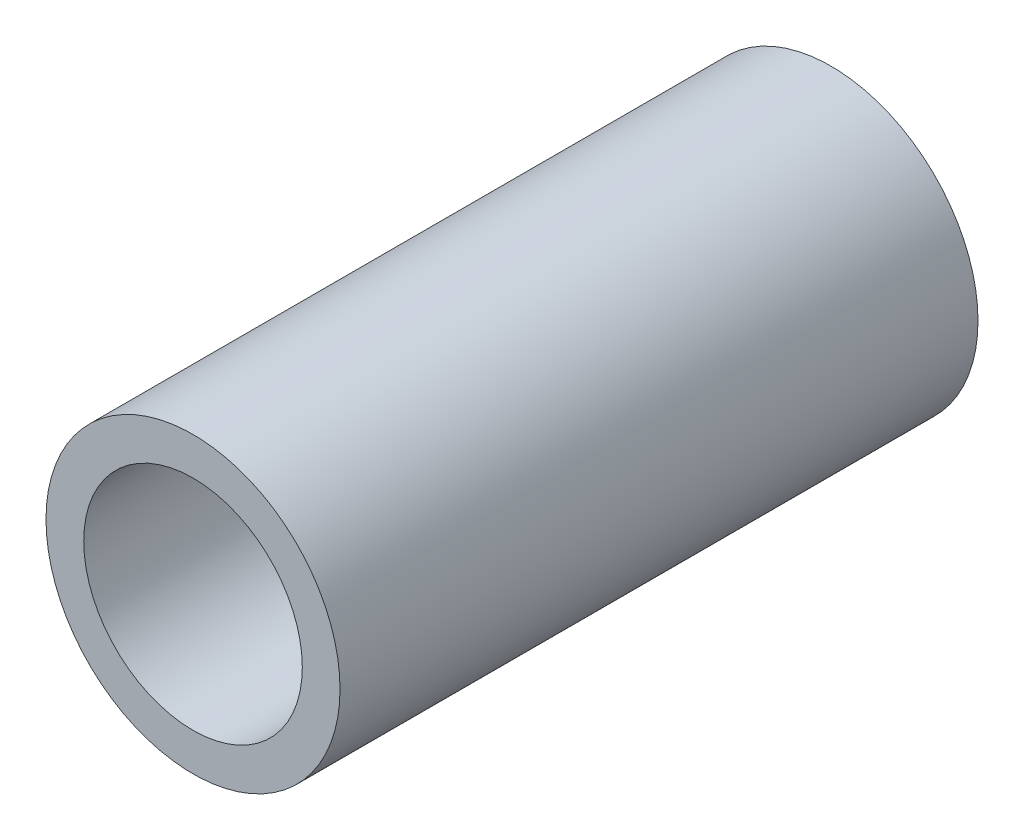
SolidWorks part; units mm, degrees
ref_plane "Front Plane" through (0, 0, 0) normal (0, 0, 1) x (1, 0, 0)
ref_plane "Top Plane" through (0, 0, 0) normal (0, 1, 0) x (1, 0, 0)
ref_plane "Right Plane" through (0, 0, 0) normal (1, 0, 0) x (0, 0, -1)
sketch "Sketch1" plane through (0, 0, 0) normal (0, 0, 1) x (1, 0, 0)
  circle A0 centre (0, 0) radius 5.0038
  circle A1 centre (0, 0) radius 6.731
  dimension "D1" = 13.462
  dimension "D2" = 10.0076
extrude "Boss-Extrude1" add sketch "Sketch1" along normal blind 29.21
